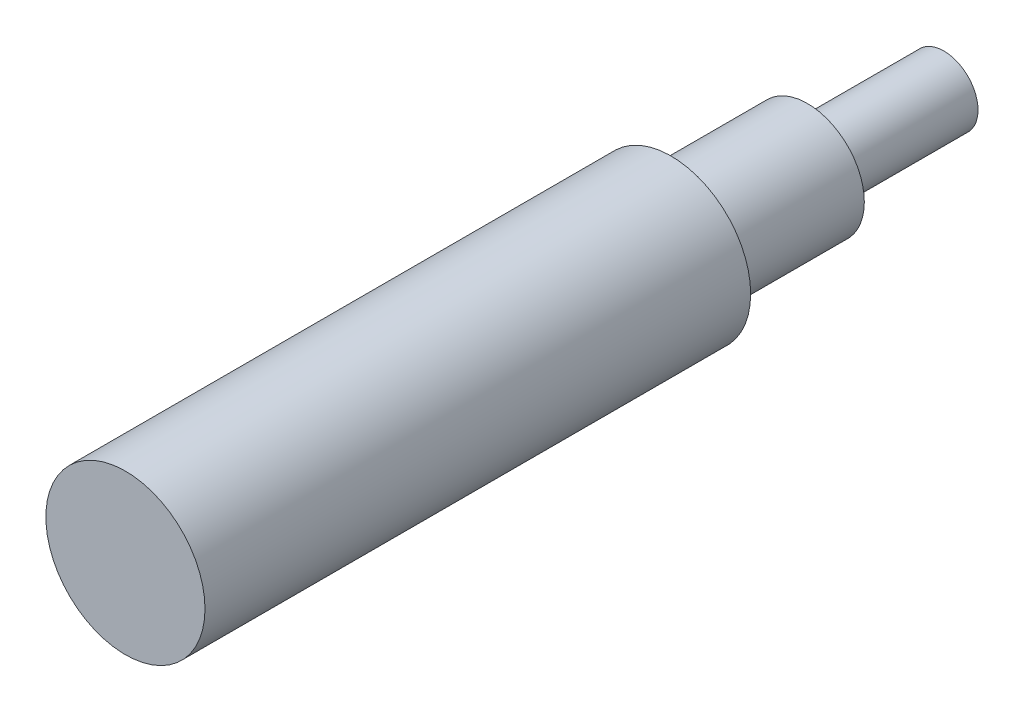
SolidWorks part; units mm, degrees
ref_plane "Alzado" through (0, 0, 0) normal (0, 0, 1) x (1, 0, 0)
ref_plane "Planta" through (0, 0, 0) normal (0, 1, 0) x (1, 0, 0)
ref_plane "Vista lateral" through (0, 0, 0) normal (1, 0, 0) x (0, 0, -1)
sketch "Croquis2" plane through (0, 0, 0) normal (0, 0, 1) x (1, 0, 0)
  circle A0 centre (0, 0) radius 12.5
  dimension "D1" = 25
extrude "Saliente-Extruir1" add sketch "Croquis2" along normal blind 150
sketch "Croquis4" plane through (0, 0, 0) normal (0, 0, -1) x (-1, 0, 0)
  circle A0 centre (0, 0) radius 7.5
  dimension "D1" = 15
extrude "Saliente-Extruir2" add sketch "Croquis4" along normal blind 30
sketch "Croquis5" plane through (0, 0, -30) normal (0, 0, -1) x (-1, 0, 0)
  circle A0 centre (0, 0) radius 6
  dimension "D1" = 12
extrude "Cortar-Extruir1" cut sketch "Croquis5" against normal blind 30
sketch "Croquis6" plane through (0, 0, 150) normal (0, 0, 1) x (1, 0, 0)
  circle A0 centre (0, 0) radius 17.5
  dimension "D1" = 35
extrude "Saliente-Extruir3" add sketch "Croquis6" against normal blind 120
